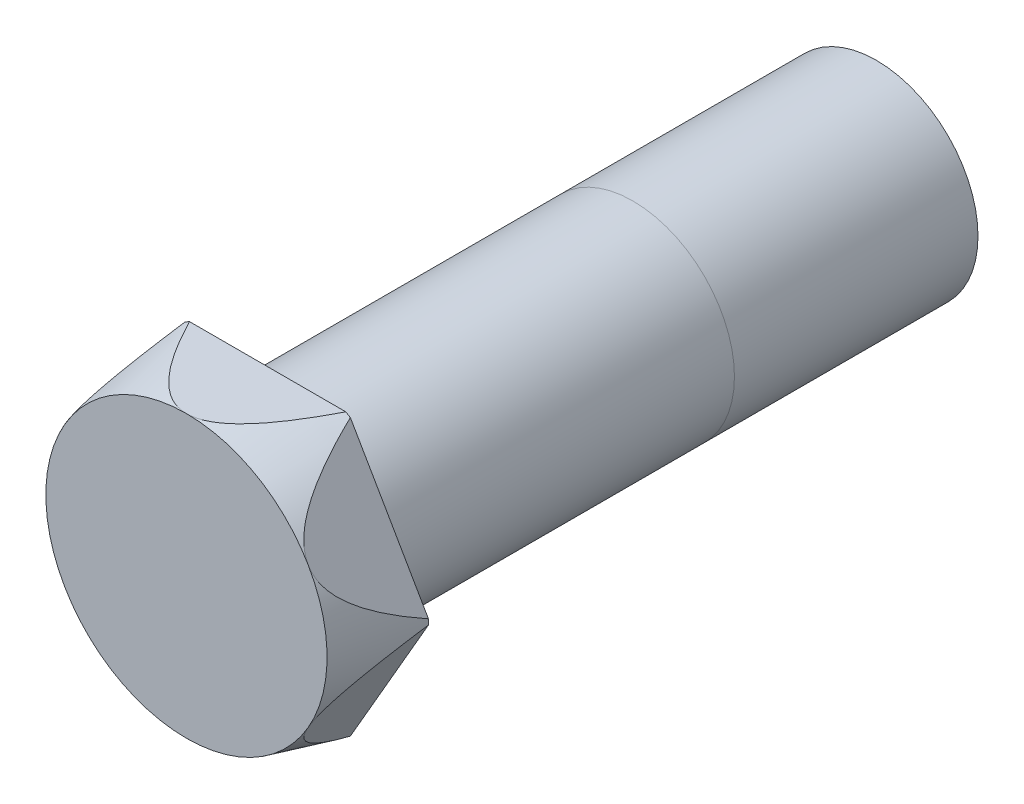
SolidWorks part; units mm, degrees
ref_plane "Front Plane" through (0, 0, 0) normal (0, 0, 1) x (1, 0, 0)
ref_plane "Top Plane" through (0, 0, 0) normal (0, 1, 0) x (1, 0, 0)
ref_plane "Right Plane" through (0, 0, 0) normal (1, 0, 0) x (0, 0, -1)
sketch "Sketch1" plane through (0, 0, 0) normal (0, 0, 1) x (1, 0, 0)
  line L1 (-2.54, 4.3994) -> (-5.08, 0)
  line L2 (-5.08, 0) -> (-2.54, -4.3994)
  line L3 (-2.54, -4.3994) -> (2.54, -4.3994)
  line L4 (2.54, -4.3994) -> (5.08, 0)
  line L5 (5.08, 0) -> (2.54, 4.3994)
  line L6 (2.54, 4.3994) -> (-2.54, 4.3994)
  circle A0 centre (0, 0) radius 4.3994 construction
  dimension "D1" = 5.08
extrude "Boss-Extrude1" add sketch "Sketch1" along normal blind 2.54
sketch "Sketch2" plane through (0, 0, 0) normal (0, 0, -1) x (-1, 0, 0)
  circle A0 centre (0, 0) radius 3.175
  dimension "D1" = 6.35
extrude "Boss-Extrude2" add sketch "Sketch2" along normal blind 19.05
sketch "Sketch3" plane through (0, 0, 2.54) normal (0, 0, 1) x (1, 0, 0)
  circle A0 centre (0, 0) radius 4.3994
  dimension "D1" = 8.7988
extrude "Cut-Extrude1" cut sketch "Sketch3" against normal blind 19.05 draft 14 flip side to cut
sketch "Sketch4" plane through (0, 0, 0) normal (0, 1, 0) x (1, 0, 0)
  line L0 (-3.175, 11.43) -> (3.175, 11.43)
  line L1 (-3.175, 19.05) -> (-3.175, 0) construction
  line L2 (3.175, 0) -> (3.175, 19.05) construction
  line L3 (3.175, 19.05) -> (-3.175, 19.05) construction
  dimension "D1" = 7.62
